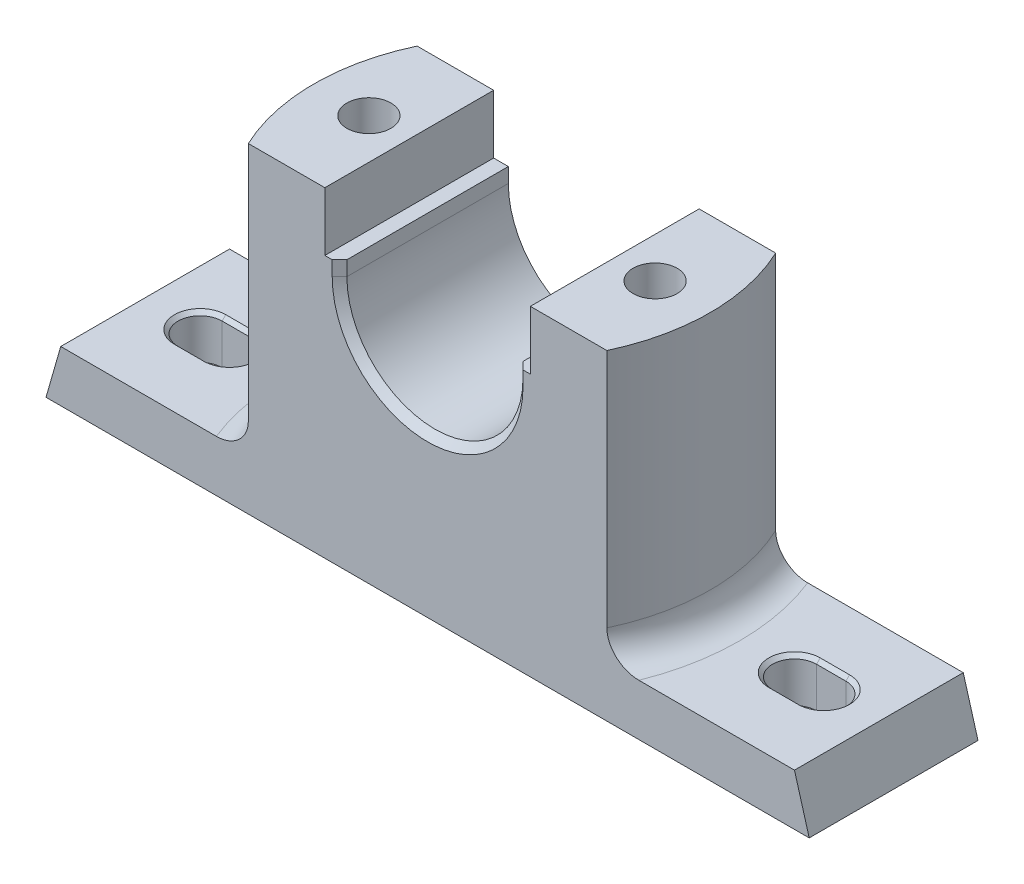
SolidWorks part; units mm, degrees
ref_plane "Front Plane" through (0, 0, 0) normal (0, 0, 1) x (1, 0, 0)
ref_plane "Top Plane" through (0, 0, 0) normal (0, 1, 0) x (1, 0, 0)
ref_plane "Right Plane" through (0, 0, 0) normal (1, 0, 0) x (0, 0, -1)
sketch "Sketch1" plane through (0, 0, 0) normal (0, 0, 1) x (1, 0, 0)
  line L0 (233.4736, 230.4857) -> (233.4736, -25.9765) construction
  line L1 (337.4736, 56.4117) -> (129.4736, 56.4117)
  line L2 (129.4736, 56.4117) -> (133.4881, 70.4117)
  line L3 (337.4736, 56.4117) -> (333.4592, 70.4117)
  line L4 (133.4881, 70.4117) -> (179.4736, 70.4117)
  line L5 (333.4592, 70.4117) -> (287.4736, 70.4117)
  line L6 (179.4736, 70.4117) -> (179.4736, 143.8822)
  line L7 (287.4736, 70.4117) -> (287.4736, 143.8822)
  line L8 (179.4736, 143.8822) -> (205.4736, 143.8822)
  line L9 (287.4736, 143.8822) -> (261.4736, 143.8822)
  line L10 (205.4736, 143.8822) -> (205.4736, 127.8822)
  line L11 (261.4736, 143.8822) -> (261.4736, 127.8822)
  line L12 (205.4736, 127.8822) -> (209.4736, 127.8822)
  line L13 (261.4736, 127.8822) -> (257.4736, 127.8822)
  line L14 (209.4736, 127.8822) -> (209.4736, 123.8822)
  line L15 (257.4736, 127.8822) -> (257.4736, 123.8822)
  arc A0 (209.4736, 123.8822) -> (257.4736, 123.8822) centre (233.4736, 123.8822) ccw
  point P5 (233.4736, 56.4117)
  dimension "D5" = 24
  dimension "D1" = 74
  dimension "D2" = 208
  dimension "D3" = 14
  dimension "D4" = 16
  dimension "D6" = 4
  dimension "D7" = 4
  dimension "D8" = 54
extrude "Boss-Extrude1" add sketch "Sketch1" along normal mid plane 46
sketch "Sketch3" plane through (0, 143.8822, 0) normal (0, 1, 0) x (1, 0, 0)
  line L4 (184.6167, 23) -> (282.3306, 23)
  line L5 (184.6167, -23) -> (282.3306, -23)
  arc A0 (184.6167, 23) -> (184.6167, -23) centre (233.4736, 0) ccw
  arc A1 (282.3306, -23) -> (282.3306, 23) centre (233.4736, 0) ccw
extrude "Cut-Extrude7" cut sketch "Sketch3" against normal up to surface (73.4704 mm away) flip side to cut
sketch "Sketch5" plane through (0, 56.4117, 0) normal (0, -1, 0) x (1, 0, 0)
  line L9 (135.9736, 17.5) -> (330.9736, 17.5)
  line L10 (135.9736, 17.5) -> (135.9736, -17.5)
  line L11 (135.9736, -17.5) -> (330.9736, -17.5)
  line L20 (330.9736, 17.5) -> (330.9736, -17.5)
  dimension "D2" = 195
  dimension "D3" = 35
extrude "Cut-Extrude9" cut sketch "Sketch5" against normal blind 2
sketch "Sketch6" plane through (0, 58.4117, 0) normal (0, -1, 0) x (1, 0, 0)
  line L0 (129.4736, 23) -> (129.4736, -23) construction
  line L1 (129.4736, 23) -> (129.4736, -23)
  line L2 (129.4736, 23) -> (337.4736, 23) construction
  line L3 (337.4736, 23) -> (337.4736, -23) construction
  line L4 (129.4736, -23) -> (337.4736, -23) construction
  line L5 (129.4736, 23) -> (337.4736, 23)
  line L6 (337.4736, 23) -> (337.4736, -23)
  line L7 (129.4736, -23) -> (337.4736, -23)
  line L8 (120.9183, 0) -> (352.7651, 0) construction
  line L9 (233.4736, 50.707) -> (233.4736, -46.3841) construction
  line L11 (194.4736, 0) -> (194.4736, 14)
  line L12 (194.4736, 14) -> (180.4736, 14)
  line L13 (180.4736, 14) -> (180.4736, -14)
  line L14 (180.4736, -14) -> (208.4736, -14)
  line L15 (208.4736, -14) -> (208.4736, 14)
  line L16 (208.4736, 14) -> (194.4736, 14)
  line L17 (194.4736, 14) -> (208.4736, 14)
  line L19 (272.4736, 14) -> (286.4736, 14)
  line L20 (286.4736, 14) -> (286.4736, -14)
  line L21 (286.4736, -14) -> (258.4736, -14)
  line L22 (258.4736, -14) -> (258.4736, 14)
  line L23 (258.4736, 14) -> (272.4736, 14)
  dimension "D1" = 14
  dimension "D2" = 14
  dimension "D3" = 14
  dimension "D4" = 14
  dimension "D6" = 28
  dimension "D7" = 28
extrude "Cut-Extrude10" cut sketch "Sketch6" against normal blind 10
sketch "Sketch8" plane through (0, 143.8822, 0) normal (0, 1, 0) x (1, 0, 0)
  line L0 (333.4592, 23) -> (282.3306, 23) construction
  line L1 (333.4592, -23) -> (333.4592, 23) construction
  line L2 (333.4592, -23) -> (282.3306, -23) construction
  line L3 (282.3306, 23) -> (261.4736, 23)
  line L4 (261.4736, 23) -> (261.4736, -23)
  line L5 (261.4736, -23) -> (282.3306, -23)
  line L6 (282.3306, 23) -> (261.4736, 23)
  line L7 (261.4736, 23) -> (261.4736, -23)
  line L8 (261.4736, -23) -> (282.3306, -23)
  line L9 (333.4592, 23) -> (282.3306, 23)
  line L10 (333.4592, -23) -> (333.4592, 23)
  line L11 (333.4592, -23) -> (282.3306, -23)
  arc A1 (282.3306, -23) -> (282.3306, 23) centre (233.4736, 0) ccw
  arc A2 (282.3306, -23) -> (282.3306, 23) centre (233.4736, 0) ccw
  dimension "D1" = 0
fillet "Fillet1" radius 8 2 edges at (287.4736, 70.4117, 0) (179.4736, 70.4117, 0)
sketch "Sketch13" plane through (0, 70.4117, 0) normal (0, 1, 0) x (1, 0, 0)
  line L0 (175.8976, 23) -> (133.4881, 23) construction
  line L1 (133.4881, -23) -> (133.4881, 23) construction
  line L2 (175.8976, -23) -> (133.4881, -23) construction
  line L3 (333.4592, 23) -> (291.0497, 23)
  line L4 (291.0497, -23) -> (333.4592, -23)
  line L5 (333.4592, -23) -> (333.4592, 23)
  line L6 (333.4592, 23) -> (291.0497, 23)
  line L7 (291.0497, -23) -> (333.4592, -23)
  line L8 (333.4592, -23) -> (333.4592, 23)
  line L9 (175.8976, 23) -> (133.4881, 23)
  line L10 (133.4881, -23) -> (133.4881, 23)
  line L11 (175.8976, -23) -> (133.4881, -23)
  line L12 (356.4636, 0) -> (124.7867, 0) construction
  line L13 (233.4736, 48.8122) -> (233.4736, -53.2437) construction
  line L14 (318.4736, -6) -> (310.4736, -6)
  line L15 (318.4736, 6) -> (310.4736, 6)
  line L19 (148.4736, 6) -> (156.4736, 6)
  line L20 (148.4736, -6) -> (156.4736, -6)
  arc A0 (318.4736, 6) -> (318.4736, -6) centre (318.4736, 0) cw
  arc A1 (291.0497, -23) -> (291.0497, 23) centre (233.4736, 0) ccw
  arc A2 (291.0497, -23) -> (291.0497, 23) centre (233.4736, 0) ccw
  arc A3 (310.4736, -6) -> (310.4736, 6) centre (310.4736, 0) cw
  arc A4 (148.4736, 6) -> (148.4736, -6) centre (148.4736, 0) ccw
  arc A5 (156.4736, -6) -> (156.4736, 6) centre (156.4736, 0) ccw
  dimension "D6" = 12
  dimension "D2" = 154
  dimension "D5" = 8
  dimension "D1" = 0
extrude "Cut-Extrude11" cut sketch "Sketch13" against normal through all contours L20 A5 L19 A4 | A3 L14 A0 L15
chamfer "Chamfer1" distance 1 angle 45 8 edges at (152.4736, 70.4117, 6) (142.4736, 70.4117, 0) (162.4736, 70.4117, 0) (152.4736, 70.4117, -6) (314.4736, 70.4117, 6) (324.4736, 70.4117, 0) (304.4736, 70.4117, 0) (314.4736, 70.4117, -6)
chamfer "Chamfer2" distance 2 angle 45 3 edges at (209.4736, 125.8822, 23) (233.4736, 99.8822, 23) (257.4736, 125.8822, 23)
sketch "Sketch15" plane through (0, 58.4117, 0) normal (0, -1, 0) x (-1, 0, 0)
  line L0 (-209.4736, 23) -> (-257.4736, 23) construction
  line L1 (-259.4736, -23) -> (-207.4736, -23) construction
  line L2 (-209.4736, 23) -> (-257.4736, 23)
  line L3 (-259.4736, -23) -> (-207.4736, -23)
  line L4 (-233.4736, 40.0631) -> (-233.4736, -45.523) construction
  line L5 (-120.1748, 0) -> (-275.2513, 0) construction
  line L8 (-129.4736, 23) -> (-133.4881, 23)
  line L9 (-129.4736, -23) -> (-129.4736, 23)
  line L10 (-133.4881, -23) -> (-129.4736, -23)
  line L11 (-133.4881, 23) -> (-133.4881, -23)
  line L12 (-129.4736, 23) -> (-133.4881, 23)
  line L13 (-129.4736, -23) -> (-129.4736, 23)
  line L14 (-133.4881, -23) -> (-129.4736, -23)
  line L15 (-133.4881, 23) -> (-133.4881, -23)
  dimension "D1" = 0
other "Hole2"
sketch "Sketch16" plane through (0, 143.8822, 0) normal (0, 1, 0) x (1, 0, 0)
  line L0 (233.4736, 40.0631) -> (233.4736, -45.523) construction
  line L1 (205.4736, -23) -> (184.6167, -23) construction
  circle A0 centre (194.4736, 0) radius 6
  dimension "D1" = 12
  dimension "D2" = 39
  dimension "D3" = 23
other "Hole3"
sketch "Sketch17" plane through (0, 143.8822, 0) normal (0, 1, 0) x (1, 0, 0)
  line L0 (233.4736, 40.0631) -> (233.4736, -45.523) construction
  line L1 (282.3306, -23) -> (261.4736, -23) construction
  circle A0 centre (272.4736, 0) radius 6
  dimension "D1" = 12
  dimension "D2" = 39
  dimension "D3" = 23
